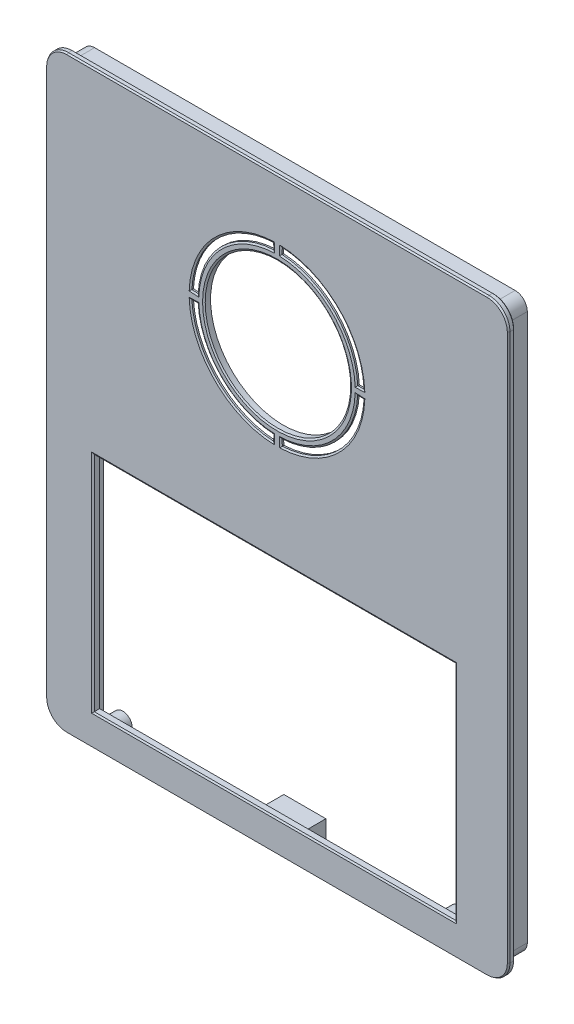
SolidWorks part; units mm, degrees
ref_plane "Ebene vorne" through (0, 0, 0) normal (0, 0, 1) x (1, 0, 0)
ref_plane "Ebene oben" through (0, 0, 0) normal (0, 1, 0) x (1, 0, 0)
ref_plane "Ebene rechts" through (0, 0, 0) normal (1, 0, 0) x (0, 0, -1)
other "Konfigurationstabelle"
sketch "Skizze1" plane through (0, 0, 0) normal (0, 0, 1) x (1, 0, 0)
  line L1 (-100, 140) -> (100, 140)
  line L2 (-110, 130) -> (-110, -130)
  line L3 (-100, -140) -> (100, -140)
  line L4 (110, 130) -> (110, -130)
  line L5 (-110, 140) -> (110, -140) construction
  line L6 (-110, -140) -> (110, 140) construction
  arc A0 (100, 140) -> (110, 130) centre (100, 130) cw
  arc A1 (-100, 140) -> (-110, 130) centre (-100, 130) ccw
  arc A2 (100, -140) -> (110, -130) centre (100, -130) ccw
  arc A3 (-110, -130) -> (-100, -140) centre (-100, -130) ccw
  point P0 (0, 0)
  dimension "D3" = 10
  dimension "D4" = 10
  dimension "D1" = 280
  dimension "D2" = 220
extrude "Aufsatz-Linear austragen1" add sketch "Skizze1" against normal blind 3
sketch "Skizze2" plane through (0, 0, 0) normal (0, 0, 1) x (1, 0, 0)
  line L14 (84.6405, -19) -> (-87.3595, -19)
  line L15 (84.6405, -19) -> (84.6405, -125)
  line L17 (84.6405, -125) -> (-87.3595, -125)
  line L18 (-87.3595, -19) -> (-87.3595, -125)
extrude "screen-cutout" cut sketch "Skizze2" against normal through all
sketch "Skizze94" [suppressed] plane through (0, 0, 0) normal (0, 0, 1) x (1, 0, 0)
  line L1 (-121.01, -125) -> (120.99, -125)
  line L2 (-121.01, -125) -> (-121.01, 24)
  line L3 (-121.01, 24) -> (120.99, 24)
  line L4 (120.99, -125) -> (120.99, 24)
  line L5 (-121.01, -125) -> (120.99, 24) construction
  line L6 (-121.01, 24) -> (120.99, -125) construction
  line L7 (-113, -120.5) -> (112.98, -120.5)
  line L8 (-113, -120.5) -> (-113, 19.5)
  line L9 (-113, 19.5) -> (112.98, 19.5)
  line L10 (112.98, -120.5) -> (112.98, 19.5)
  line L11 (-113, -120.5) -> (112.98, 19.5) construction
  line L12 (-113, 19.5) -> (112.98, -120.5) construction
  point P0 (-0.01, -50.5)
  point P9 (-0.01, -50.5)
extrude "screen-frame-front-protect" [suppressed] add sketch "Skizze94" against normal blind 0.65
sketch "Skizze3" plane through (0, 0, 0) normal (0, 0, 1) x (1, 0, 0)
  line L1 (0, 140) -> (0, 0) construction
  line L3 (100, 140) -> (-100, 140) construction
  circle A0 centre (0, 70) radius 34.6
  dimension "D1" = 69.2
  dimension "D2" = 70
extrude "cam-lens-cutout" cut sketch "Skizze3" against normal through all
sketch "led-ring-diameter-ref" plane through (0, 0, 0) normal (0, 0, 1) x (1, 0, 0)
  circle A0 centre (0, 70) radius 39.5 construction
sketch "Skizze52" plane through (0, 0, -3) normal (0, 0, -1) x (-1, 0, 0)
  arc A0 (2, 109.4493) -> (39.4493, 72) centre (0, 70) cw
  arc A1 (39.4493, 68) -> (2, 30.5507) centre (0, 70) cw
  arc A2 (-2, 30.5507) -> (-39.4493, 68) centre (0, 70) cw
  arc A3 (-39.4493, 72) -> (-2, 109.4493) centre (0, 70) cw
  circle A5 centre (0, 70) radius 39.5 construction
  point P12 (0, 70)
extrude "Schnitt-Linear-Austragen-Dünn1" cut sketch "Skizze52" against normal through all thin
sketch "Skizze7" plane through (0, 0, -3) normal (0, 0, -1) x (-1, 0, 0)
  line L1 (17, 55.5) -> (-17, 55.5) construction
  line L2 (17, 55.5) -> (17, 84.5) construction
  line L3 (17, 84.5) -> (-17, 84.5) construction
  line L4 (-17, 55.5) -> (-17, 84.5) construction
  line L5 (17, 55.5) -> (-17, 84.5) construction
  line L6 (17, 84.5) -> (-17, 55.5) construction
  circle A0 centre (-17, 84.5) radius 4.5
  circle A1 centre (-17, 55.5) radius 4.5
  circle A2 centre (17, 55.5) radius 4.5
  circle A3 centre (17, 84.5) radius 4.5
  point P12 (0, 70)
  dimension "D1" = 9
  dimension "D2" = 34
  dimension "D3" = 29
extrude "Aufsatz-Linear austragen3" [suppressed] add sketch "Skizze7" along normal blind 11
sketch "Skizze51" plane through (0, 0, -3) normal (0, 0, -1) x (-1, 0, 0)
  circle A0 centre (0, 70) radius 20
  dimension "D1" = 40
extrude "Schnitt-Linear austragen5" [suppressed] cut sketch "Skizze51" along normal up to surface (11 mm away) contours A0
sketch "Skizze30" plane through (0, 0, -3) normal (0, 0, -1) x (-1, 0, 0)
  line L20 (87.3595, -19) -> (87.3595, -125) construction
  line L21 (87.3595, -125) -> (-84.6405, -125) construction
  line L22 (-84.6405, -125) -> (-84.6405, -19) construction
  line L23 (-84.6405, -19) -> (87.3595, -19) construction
  line L24 (87.3595, -19) -> (87.3595, -125)
  line L25 (87.3595, -125) -> (-84.6405, -125)
  line L26 (-84.6405, -125) -> (-84.6405, -19)
  line L27 (-84.6405, -19) -> (87.3595, -19)
sketch "Skizze57" plane through (0, 0, -3) normal (0, 0, -1) x (-1, 0, 0)
  circle A0 centre (0, 70) radius 44
  circle A1 centre (0, 70) radius 35
  circle A2 centre (0, 70) radius 39.5 construction
extrude "Schnitt-Linear austragen6" cut sketch "Skizze57" against normal offset from surface (1.8 mm away) 1.2
fillet "Verrundung4" [suppressed] radius 1
ref_plane "Ebene3" through (0, 0, -1.5) normal (0, 0, 1) x (1, 0, 0)
hole_wizard "Ø2.8 (2.8) Durchmesser Bohrung1" positions "Skizze9" profile "Skizze10" hole size "Ø2.8" standard "DIN"
sketch "Skizze9" [suppressed] plane through (0, 0, -14) normal (0, 0, -1) x (-1, 0, 0)
  point P0 (-17, 84.5)
  point P3 (-17, 55.5)
  point P6 (17, 55.5)
  point P9 (17, 84.5)
sketch "Skizze10" plane through (17, 84.5, -14) normal (1, 0, 0) x (0, 1, 0)
  line L0 (0, 0) -> (0, 10)
  line L1 (0, 10) -> (1.4, 9.1588)
  line L2 (1.4, 9.1588) -> (1.4, 0)
  line L5 (1.4, 0) -> (0, 0)
  line L10 (0, 10) -> (-1.4, 9.1588) construction
  line L11 (0, -6.35) -> (0, 107.95) construction
  dimension "Bohrerdurchmesser" = 2.8
  dimension "Bohrungstiefe" = 10
  dimension "Spitzenwinkel" = 118
sketch "Skizze72" plane through (0, 0, -3) normal (0, 0, -1) x (-1, 0, 0)
  circle A0 centre (-78.6405, -14) radius 4.5
  circle A1 centre (-78.6405, -130) radius 4.5
  circle A2 centre (81.3595, -130) radius 4.5
  circle A3 centre (81.3595, -14) radius 4.5
  dimension "D3" = 9
extrude "Aufsatz-Linear austragen20" add sketch "Skizze72" along normal blind 5
sketch "Skizze73" plane through (0, 0, -8) normal (0, 0, -1) x (-1, 0, 0)
  point P0 (-78.6405, -14)
  point P3 (-78.6405, -130)
  point P6 (81.3595, -130)
  point P9 (81.3595, -14)
hole_wizard "Ø4.2 (4.2) Durchmesser Bohrung2" positions "Skizze73" profile "Skizze74" hole size "Ø4.2" standard "DIN"
sketch "Skizze74" plane through (78.6405, -14, -8) normal (1, 0, 0) x (0, 1, 0)
  line L0 (0, 0) -> (0, 6)
  line L1 (0, 6) -> (2.1, 6)
  line L2 (2.1, 6) -> (2.1, 0)
  line L5 (2.1, 0) -> (0, 0)
  line L10 (0, 6) -> (-2.1, 6) construction
  line L11 (0, -6.35) -> (0, 107.95) construction
  dimension "Bohrerdurchmesser" = 4.2
  dimension "Bohrungstiefe" = 6
  dimension "Spitzenwinkel" = 180
sketch "Skizze77" plane through (0, 0, -3) normal (0, 0, -1) x (-1, 0, 0)
  line L0 (95.8, -135.8) -> (100, -135.8)
  line L13 (-100, -135.8) -> (100, -135.8)
  line L18 (-100, -135.8) -> (-95.8, -135.8)
  line L19 (-95.8, -135.8) -> (-95.8, 125.8)
  line L20 (-95.8, 125.8) -> (95.8, 125.8)
  line L21 (95.8, 125.8) -> (95.8, -135.8)
  line L22 (-105.8, 130) -> (-105.8, -130)
  line L24 (105.8, -130) -> (105.8, 130)
  line L25 (100, 135.8) -> (-100, 135.8)
  line L26 (-105.8, 130) -> (-105.8, -130)
  line L28 (105.8, -130) -> (105.8, 130)
  line L29 (100, 135.8) -> (-100, 135.8)
  arc A10 (-105.8, -130) -> (-100, -135.8) centre (-100, -130) ccw
  arc A18 (-100, 135.8) -> (-105.8, 130) centre (-100, 130) ccw
  arc A21 (105.8, 130) -> (100, 135.8) centre (100, 130) ccw
  arc A22 (-100, 135.8) -> (-105.8, 130) centre (-100, 130) ccw
  arc A25 (105.8, 130) -> (100, 135.8) centre (100, 130) ccw
  arc A51 (-105.8, -130) -> (-100, -135.8) centre (-100, -130) ccw
  arc A53 (100, -135.8) -> (105.8, -130) centre (100, -130) ccw
  arc A55 (100, -135.8) -> (105.8, -130) centre (100, -130) ccw
  point P0 (0, 125.8)
extrude "Aufsatz-Linear austragen21" add sketch "Skizze77" along normal up to surface (10.25 mm away)
sketch "Skizze88" plane through (0, 0, -3) normal (0, 0, -1) x (-1, 0, 0)
  line L0 (95.8, 125.8) -> (95.8, -135.8) construction
  line L1 (-95.8, -135.8) -> (95.8, -135.8)
  line L2 (-95.8, -135.8) -> (-95.8, -133.4)
  line L3 (-95.8, -133.4) -> (95.8, -133.4)
  line L4 (95.8, -135.8) -> (95.8, -133.4)
  dimension "D1" = 2.4
extrude "Aufsatz-Linear austragen23" add sketch "Skizze88" along normal blind 4
sketch "Skizze92" plane through (0, 0, -3) normal (0, 0, -1) x (-1, 0, 0)
  line L1 (-95.8, -135.8) -> (95.8, -135.8) construction
  line L2 (10, -126.8) -> (-10, -126.8)
  line L3 (10, -126.8) -> (10, -135.8)
  line L4 (10, -135.8) -> (-10, -135.8)
  line L5 (-10, -126.8) -> (-10, -135.8)
  line L6 (10, -126.8) -> (-10, -135.8) construction
  line L7 (10, -135.8) -> (-10, -126.8) construction
  point P0 (0, -131.3)
  dimension "D1" = 9
  dimension "D2" = 20
extrude "Aufsatz-Linear austragen24" add sketch "Skizze92" along normal up to surface (10.25 mm away)
sketch "Skizze80" plane through (0, 0, -13.25) normal (0, 0, -1) x (-1, 0, 0)
  line L0 (-95.8, -125.8) -> (-95.8, 125.8)
  line L1 (-95.8, -133.4) -> (-95.8, 125.8) construction
  line L2 (-95.8, 125.8) -> (95.8, 125.8)
  line L3 (95.8, 125.8) -> (95.8, -125.8)
  line L4 (-95.8, -135.8) -> (-10, -135.8) construction
  line L6 (95.8, 125.8) -> (95.8, -133.4) construction
  dimension "D1" = 10
sketch "Skizze81" plane through (-23.6, 0, 0) normal (0, 1, 0) x (1, 0, 0)
  circle A1 centre (-72.2, 13.25) radius 2.5
  dimension "D1" = 5
extrude "Schnitt-Linear-Austragen-Dünn3" cut sketch "Skizze81" along normal mid plane 4.5 from offset 25 thin
pattern_linear "Lineares Muster6" count 2 spacing 50 along (0, 1, 0) count 3 spacing 50 along (0, -1, 0) of "Schnitt-Linear-Austragen-Dünn3"
mirror "Spiegeln1" about plane through (0, 0, 0) normal (1, 0, 0) of "Schnitt-Linear-Austragen-Dünn3", "Lineares Muster6"
hole_wizard "Ø4.2 (4.2) Durchmesser Bohrung3" positions "Skizze78" profile "Skizze79" hole size "Ø4.2" standard "DIN"
sketch "Skizze78" plane through (0, 0, -13.25) normal (0, 0, -1) x (-1, 0, 0)
  line L0 (159.5815, 130.8) -> (-159.5815, 130.8) construction
  line L2 (-100.8, 275.7) -> (-100.8, -147.9265) construction
  line L5 (100.8, -144.4551) -> (100.8, 275.7) construction
  line L7 (0, 135.8) -> (0, 125.8) construction
  line L11 (0, -7.2875) -> (0, 7.2875) construction
  line L12 (105.8, 125.8) -> (95.8, 125.8) construction
  line L16 (-105.8, 125.8) -> (-95.8, 125.8) construction
  line L24 (-95.8, 125.8) -> (95.8, 125.8) construction
  line L25 (100, 135.8) -> (-100, 135.8) construction
  line L26 (-105.8, 130) -> (-105.8, -130) construction
  line L27 (105.8, -130) -> (105.8, 130) construction
  point P0 (-25, 130.8)
  point P83 (100.8, 125.8)
  point P84 (-100.8, 125.8)
  point P92 (0, 130.8)
  dimension "D1" = 25
sketch "Skizze79" plane through (25, 130.8, -13.25) normal (1, 0, 0) x (0, 1, 0)
  line L0 (0, 0) -> (0, 7)
  line L1 (0, 7) -> (2.1, 7)
  line L2 (2.1, 7) -> (2.1, 0)
  line L5 (2.1, 0) -> (0, 0)
  line L10 (0, 7) -> (-2.1, 7) construction
  line L11 (0, -6.35) -> (0, 107.95) construction
  dimension "Bohrerdurchmesser" = 4.2
  dimension "Bohrungstiefe" = 7
  dimension "Spitzenwinkel" = 180
pattern_linear "Lineares Muster3" count 2 spacing 50 along (1, 0, 0) count 3 spacing 50 along (-1, 0, 0) of "Ø4.2 (4.2) Durchmesser Bohrung3"
sketch "Skizze83" plane through (0, 0, -13.25) normal (0, 0, -1) x (-1, 0, 0)
  line L0 (-105.8, 110.8) -> (-95.8, 110.8) construction
  line L4 (105.8, 110.8) -> (95.8, 110.8) construction
  line L10 (100, 135.8) -> (-100, 135.8) construction
  line L12 (-95.8, -133.4) -> (-95.8, 125.8) construction
  line L13 (-105.8, 130) -> (-105.8, -130) construction
  line L14 (95.8, 125.8) -> (95.8, -133.4) construction
  line L15 (105.8, -130) -> (105.8, 130) construction
  point P0 (-100.8, 110.8)
  point P2 (100.8, 110.8)
  point P17 (-100.8, 110.8)
  point P28 (100.8, 110.8)
  dimension "D1" = 25
hole_wizard "Ø4.2 (4.2) Durchmesser Bohrung4" positions "Skizze83" profile "Skizze84" hole size "Ø4.2" standard "DIN"
sketch "Skizze84" plane through (100.8, 110.8, -13.25) normal (1, 0, 0) x (0, 1, 0)
  line L0 (0, 0) -> (0, 7)
  line L1 (0, 7) -> (2.1, 7)
  line L2 (2.1, 7) -> (2.1, 0)
  line L5 (2.1, 0) -> (0, 0)
  line L10 (0, 7) -> (-2.1, 7) construction
  line L11 (0, -6.35) -> (0, 107.95) construction
  dimension "Bohrerdurchmesser" = 4.2
  dimension "Bohrungstiefe" = 7
  dimension "Spitzenwinkel" = 180
pattern_linear "Lineares Muster5" count 5 spacing 50 along (0, -1, 0) of "Ø4.2 (4.2) Durchmesser Bohrung4"
sketch "Skizze85" plane through (0, 0, -3) normal (0, 0, -1) x (-1, 0, 0)
  line L1 (-65, 37.5) -> (65, 37.5) construction
  line L2 (-65, 37.5) -> (-65, 102.5) construction
  line L3 (-65, 102.5) -> (65, 102.5) construction
  line L4 (65, 37.5) -> (65, 102.5) construction
  line L5 (-65, 37.5) -> (65, 102.5) construction
  line L6 (-65, 102.5) -> (65, 37.5) construction
  circle A0 centre (-65, 102.5) radius 7.5
  circle A1 centre (-65, 37.5) radius 7.5
  circle A2 centre (65, 37.5) radius 7.5
  circle A3 centre (65, 102.5) radius 7.5
  point P8 (0, 70)
  dimension "D1" = 15
  dimension "D2" = 130
  dimension "D3" = 65
extrude "Aufsatz-Linear austragen22" add sketch "Skizze85" along normal blind 10
sketch "Skizze93" plane through (0, 0, -3) normal (0, 0, -1) x (-1, 0, 0)
  line L1 (-50.9707, 122.2173) -> (-50.9707, 125.8)
  line L2 (-95.8, 125.8) -> (95.8, 125.8) construction
  line L3 (50.9707, 122.2173) -> (50.9707, 125.8)
  line L4 (-66.5984, 37.5) -> (-95.8, 37.5)
  line L5 (-95.8, -133.4) -> (-95.8, 125.8) construction
  line L6 (66.5984, 37.5) -> (95.8, 37.5)
  line L7 (95.8, 125.8) -> (95.8, -133.4) construction
  arc A0 (-51.2652, 121.5085) -> (-65.6944, 38.9276) centre (0, 70) ccw
  arc A1 (51.2652, 121.5085) -> (65.6944, 38.9276) centre (0, 70) cw
  circle A2 centre (65, 37.5) radius 7.5 construction
  circle A3 centre (-65, 37.5) radius 7.5 construction
  arc A4 (65.6944, 38.9276) -> (66.5984, 37.5) centre (66.5984, 38.5) ccw
  arc A5 (51.2652, 121.5085) -> (50.9707, 122.2173) centre (51.9707, 122.2173) cw
  arc A6 (-51.2652, 121.5085) -> (-50.9707, 122.2173) centre (-51.9707, 122.2173) ccw
  arc A7 (-65.6944, 38.9276) -> (-66.5984, 37.5) centre (-66.5984, 38.5) cw
  point P22 (65, 37.5)
  point P25 (50.9707, 121.8)
  point P30 (-65, 37.5)
  dimension "D2" = 1
  dimension "D1" = 4
extrude "Linear-Austragen-Dünn7" add sketch "Skizze93" along normal blind 6 thin
sketch "Skizze86" plane through (0, 0, -13) normal (0, 0, -1) x (-1, 0, 0)
  point P0 (-65, 102.5)
  point P3 (-65, 37.5)
  point P6 (65, 37.5)
  point P9 (65, 102.5)
hole_wizard "Ø4.2 (4.2) Durchmesser Bohrung5" positions "Skizze86" profile "Skizze87" hole size "Ø4.2" standard "DIN"
sketch "Skizze87" plane through (65, 102.5, -13) normal (1, 0, 0) x (0, 1, 0)
  line L0 (0, 0) -> (0, 7)
  line L1 (0, 7) -> (2.1, 7)
  line L2 (2.1, 7) -> (2.1, 0)
  line L5 (2.1, 0) -> (0, 0)
  line L10 (0, 7) -> (-2.1, 7) construction
  line L11 (0, -6.35) -> (0, 107.95) construction
  dimension "Bohrerdurchmesser" = 4.2
  dimension "Bohrungstiefe" = 7
  dimension "Spitzenwinkel" = 180
chamfer "Fase10" distance 0.6 angle 45 4 edges at (-67.1, 102.5, -13) (-67.1, 37.5, -13) (62.9, 37.5, -13) (62.9, 102.5, -13)
chamfer "Fase6" distance 0.8 angle 30 29 edges at (0, 140, 0) (110, 0, 0) (-110, 0, 0) (34.6, 70, 0) (0, -140, 0) (107.0711, -137.0711, 0) (-107.0711, -137.0711, 0) (107.0711, 137.0711, 0) (-107.0711, 137.0711, 0) (-28.9914, 98.9914, 0) (-39.4493, 72, 0) (-26.8701, 96.8701, 0) (-2, 109.4493, 0) (-28.9914, 41.0086, 0) (-2, 30.5507, 0) (-26.8701, 43.1299, 0) (-39.4493, 68, 0) (28.9914, 41.0086, 0) (39.4493, 68, 0) (26.8701, 43.1299, 0) (2, 30.5507, 0) (28.9914, 98.9914, 0) (2, 109.4493, 0) (26.8701, 96.8701, 0) (39.4493, 72, 0) (-1.3595, -19, 0) (-87.3595, -72, 0) (-1.3595, -125, 0) (84.6405, -72, 0)
chamfer "Fase11" distance 0.5 angle 45 8 edges at (0, 140, -3) (-107.0711, 137.0711, -3) (-110, 0, -3) (-107.0711, -137.0711, -3) (0, -140, -3) (107.0711, -137.0711, -3) (107.0711, 137.0711, -3) (110, 0, -3)
sketch "Skizze89" plane through (0, 0, -13.25) normal (0, 0, -1) x (-1, 0, 0)
  point P0 (-100.9, 130.9)
  point P2 (-100.9, 0)
  point P4 (-100.9, -130.9)
  point P6 (0, 130.9)
  point P8 (100.9, 130.9)
  point P10 (100.9, 0)
  point P12 (100.9, -130.9)
  point P14 (0, -130.9)
hole_wizard "Ø4.2 (4.2) Durchmesser Bohrung6" positions "Skizze89" profile "Skizze91" hole size "Ø4.2" standard "DIN"
sketch "Skizze91" plane through (100.9, 130.9, -13.25) normal (1, 0, 0) x (0, 1, 0)
  line L0 (0, 0) -> (0, 8)
  line L1 (0, 8) -> (2.1, 8)
  line L2 (2.1, 8) -> (2.1, 0)
  line L5 (2.1, 0) -> (0, 0)
  line L10 (0, 8) -> (-2.1, 8) construction
  line L11 (0, -6.35) -> (0, 107.95) construction
  dimension "Bohrerdurchmesser" = 4.2
  dimension "Bohrungstiefe" = 8
  dimension "Spitzenwinkel" = 180
equation "\"D3@Skizze77\"=\"D2@Skizze77\""
equation "\"D1@Skizze52\"=\"D1@led-ring-diameter-ref\""
equation "\"D2@Skizze57\"=\"D1@led-ring-diameter-ref\""
equation "\"D3@Skizze57\"=\"D1@Skizze57\"/2"
